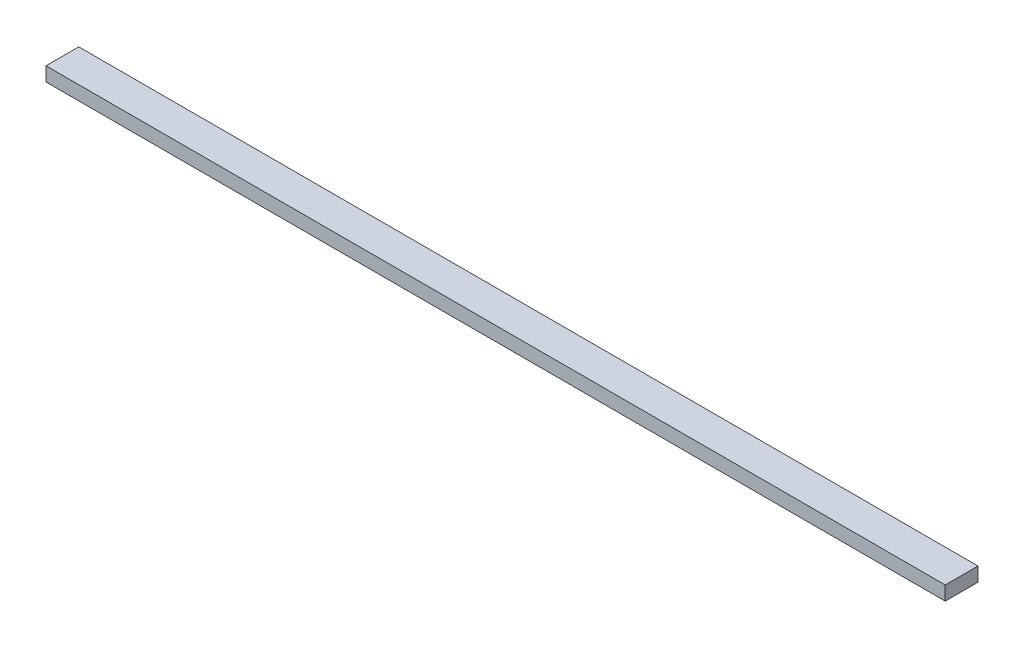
SolidWorks part; units mm, degrees
ref_plane "Front Plane" through (0, 0, 0) normal (0, 0, 1) x (1, 0, 0)
ref_plane "Top Plane" through (0, 0, 0) normal (0, 1, 0) x (1, 0, 0)
ref_plane "Right Plane" through (0, 0, 0) normal (1, 0, 0) x (0, 0, -1)
sketch "Sketch2" plane through (0, 0, 0) normal (0, 1, 0) x (1, 0, 0)
  line L1 (0, 0) -> (2438.4, 0)
  line L2 (0, 0) -> (0, 88.9)
  line L3 (0, 88.9) -> (2438.4, 88.9)
  line L4 (2438.4, 0) -> (2438.4, 88.9)
  dimension "D1" = 88.9
  dimension "D2" = 2438.4
extrude "Boss-Extrude1" add sketch "Sketch2" along normal blind 38.1
sketch "Sketch3" plane through (0, 38.1, 0) normal (0, 1, 0) x (1, 0, 0)
  line L0 (0, 88.9) -> (0, 0) construction
  line L1 (2438.4, 0) -> (2438.4, 88.9) construction
  circle A0 centre (254, 44.45) radius 25.4
  circle A1 centre (393.7, 44.45) radius 25.4
  circle A2 centre (533.4, 44.45) radius 25.4
  circle A3 centre (673.1, 44.45) radius 25.4
  circle A4 centre (812.8, 44.45) radius 25.4
  circle A5 centre (952.5, 44.45) radius 25.4
  circle A6 centre (1092.2, 44.45) radius 25.4
  circle A7 centre (1231.9, 44.45) radius 25.4
  circle A8 centre (1371.6, 44.45) radius 25.4
  circle A9 centre (1511.3, 44.45) radius 25.4
  circle A12 centre (2298.7, 44.45) radius 25.4
  circle A13 centre (1651, 44.45) radius 25.4
  circle A14 centre (1790.7, 44.45) radius 25.4
  circle A15 centre (1930.4, 44.45) radius 25.4
  circle A16 centre (2070.1, 44.45) radius 25.4
  point P4 (0, 44.45)
  dimension "D1" = 50.8
  dimension "D2" = 254
  dimension "D4" = 228.6
  dimension "D5" = 139.7
  dimension "D6" = 139.7
  dimension "D3" = 14
extrude "Cut-Extrude1" [suppressed] cut sketch "Sketch3" against normal through all
